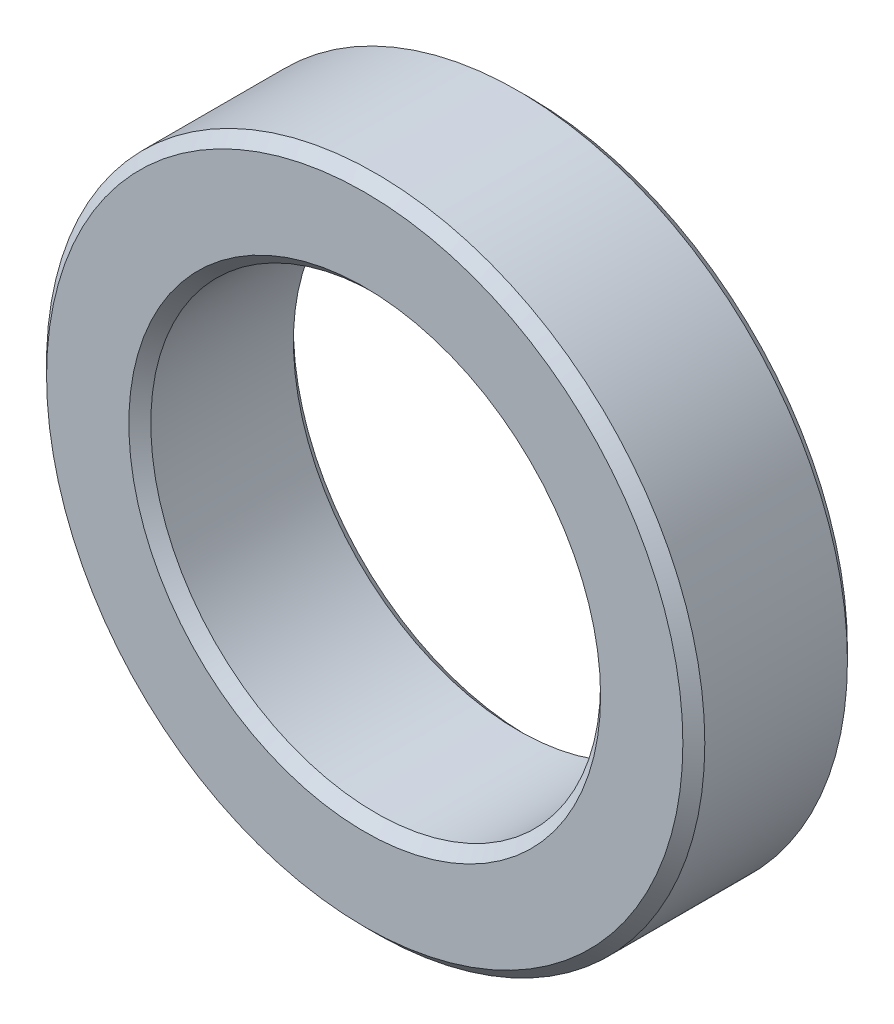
SolidWorks part; units mm, degrees
ref_plane "Front Plane" through (0, 0, 0) normal (0, 0, 1) x (1, 0, 0)
ref_plane "Top Plane" through (0, 0, 0) normal (0, 1, 0) x (1, 0, 0)
ref_plane "Right Plane" through (0, 0, 0) normal (1, 0, 0) x (0, 0, -1)
sketch "Sketch1" plane through (0, 0, 0) normal (0, 0, 1) x (1, 0, 0)
  circle A0 centre (0, 0) radius 6
  circle A1 centre (0, 0) radius 4.1
  dimension "D1" = 12
  dimension "D2" = 8.2
extrude "Boss-Extrude2" add sketch "Sketch1" along normal mid plane 3
chamfer "Chamfer3" distance 0.2 angle 45 4 edges at (6, 0, 1.5) (6, 0, -1.5) (4.1, 0, -1.5) (4.1, 0, 1.5)
